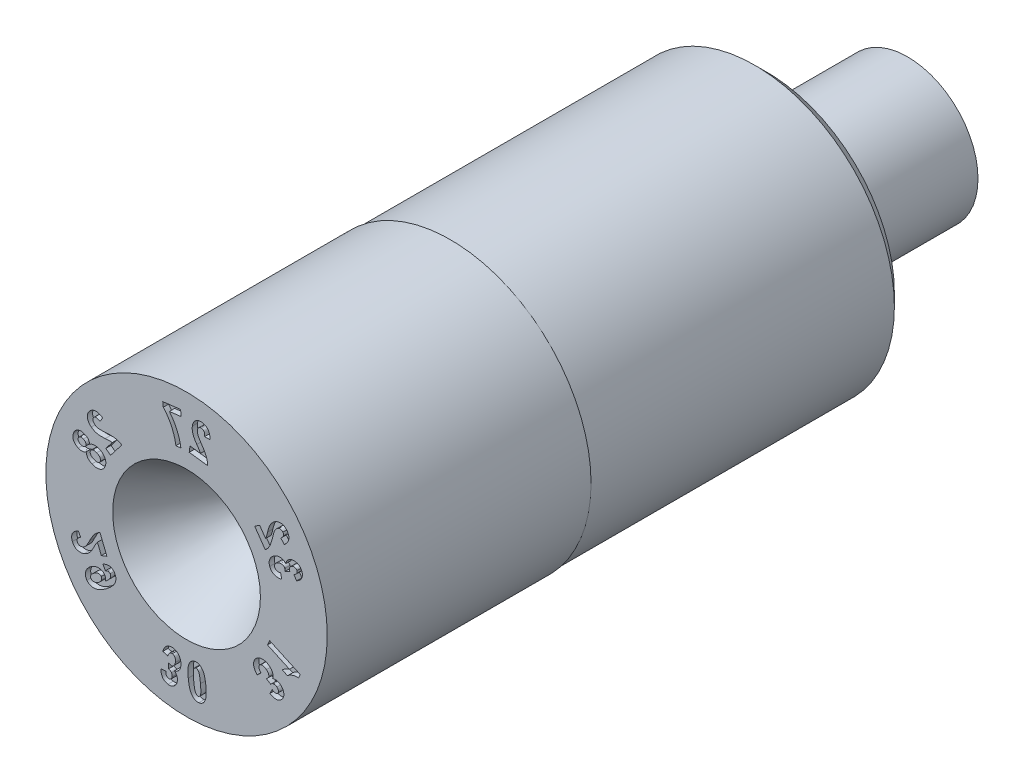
SolidWorks part; units mm, degrees
other "<M8L16-SetScrew>-<Chamfer1>"
ref_plane "Front Plane" through (0, 0, 0) normal (0, 0, 1) x (1, 0, 0)
ref_plane "Top Plane" through (0, 0, 0) normal (0, 1, 0) x (1, 0, 0)
ref_plane "Right Plane" through (0, 0, 0) normal (1, 0, 0) x (0, 0, -1)
sketch "Sketch1" plane through (0, 0, 0) normal (1, 0, 0) x (0, 0, -1)
  line L0 (0, 4.2) -> (4.2435, 1.75)
  line L2 (0, 8) -> (0, 4.2)
  line L3 (32.2458, 8) -> (0, 8)
  line L4 (-3.7979, 0) -> (49996.2021, 0) construction
  line L8 (25, 1.75) -> (4.2435, 1.75)
  line L12 (33, 4) -> (33, 7.2457)
  line L16 (33, 7.2457) -> (32.2458, 8)
  line L17 (33, 4) -> (25, 4)
  line L18 (25, 1.75) -> (25, 4)
  dimension "D1" = 33
  dimension "D2" = 45
  dimension "D3" = 0.7542
  dimension "D4" = 16
  dimension "D5" = 30
  dimension "D6" = 4.2
  dimension "D7" = 3.5
  dimension "D8" = 8
  dimension "D9" = 8
revolve "Revolve1" add sketch "Sketch1" angle 360 about L4
sketch "Sketch5" plane through (0, 0, 0) normal (1, 0, 0) x (0, 0, -1)
  line L0 (0, 0) -> (50000, 0) construction
  line L1 (0, 8) -> (0, -8) construction
  line L2 (15, 7.935) -> (33, 7.935)
  line L3 (15, 7.935) -> (15, 8.935)
  line L4 (15, 8.935) -> (33, 8.935)
  line L5 (33, 7.935) -> (33, 8.935)
  line L6 (33, -7.2457) -> (33, 7.2457) construction
  line L7 (32.2458, 8) -> (0, 8) construction
  dimension "D1" = 15
  dimension "D2" = 0.065
  dimension "D3" = 1
revolve "Cut-Revolve1" cut sketch "Sketch5" angle 360 about L0
sketch "Sketch2" plane through (0, 0, 0) normal (0, 0, 1) x (1, 0, 0)
  line L0 (0, 0) -> (0, 8) construction
  line L1 (0, 0) -> (6.9282, 4) construction
  line L2 (0, 0) -> (6.9282, -4) construction
  line L3 (0, 0) -> (0, -8) construction
  line L4 (0, 0) -> (-6.9282, -4) construction
  line L5 (0, 0) -> (-6.9282, 4) construction
  arc A0 (1.2479, 4.9627) -> (2.658, 4.3727) centre (0, 0) ccw construction
  circle A1 centre (0, 0) radius 8 construction
  text T0 "27    28    29    30    31    32" font "Arial Narrow" height 1.9
  point P18 (0, 0)
  dimension "D1" = 5.1171
  dimension "D2" = 6
extrude "Cut-Extrude1" cut sketch "Sketch2" against normal blind 0.3
ref_plane "Plane1" through (0, 0, -4.2435) normal (0, 0, 1) x (1, 0, 0)
sketch "Sketch6" plane through (0, 0, -4.2435) normal (0, 0, 1) x (1, 0, 0)
  line L1 (2.0207, 0) -> (1.0104, 1.75)
  line L2 (1.0104, 1.75) -> (-1.0104, 1.75)
  line L3 (-1.0104, 1.75) -> (-2.0207, 0)
  line L4 (-2.0207, 0) -> (-1.0104, -1.75)
  line L5 (-1.0104, -1.75) -> (1.0104, -1.75)
  line L6 (1.0104, -1.75) -> (2.0207, 0)
  circle A0 centre (0, 0) radius 1.75 construction
  circle A1 centre (0, 0) radius 1.75 construction
  point P1 (0, 1.75)
extrude "Cut-Extrude2" cut sketch "Sketch6" against normal blind 3.5 contours L3 L4 L5 L6 L1 L2
inserted part "M8L16-SetScrew"
move or copy body "Body-Move/Copy2" placed by mates yes
other "Distance1" parameters "D1"=8
